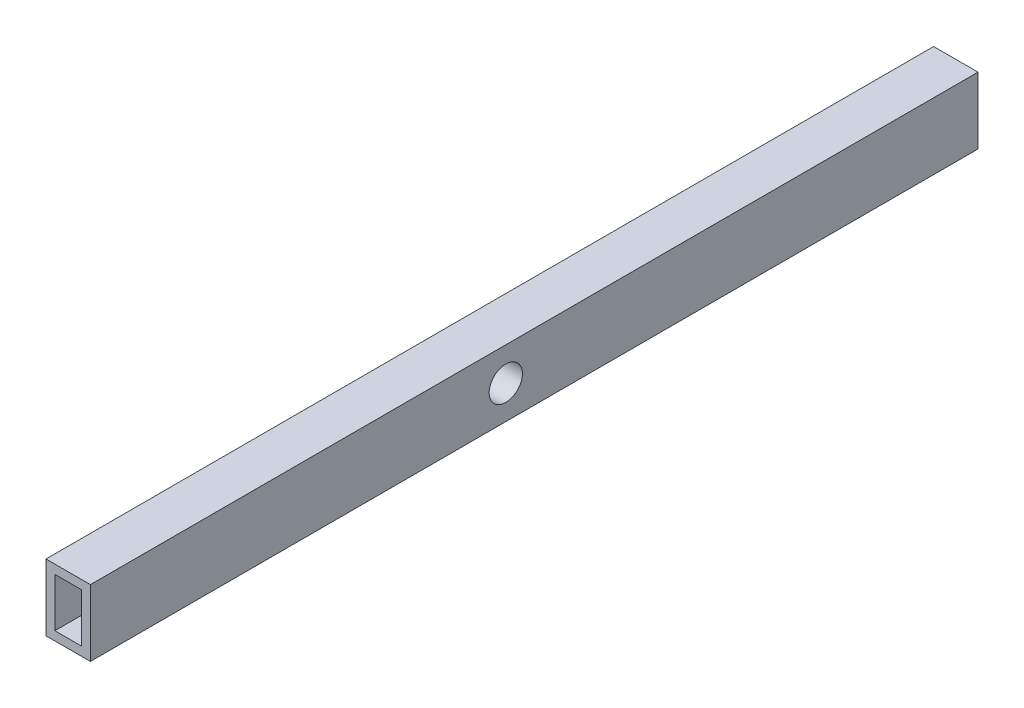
SolidWorks part; units mm, degrees
ref_plane "Front" through (0, 0, 0) normal (0, 0, 1) x (1, 0, 0)
ref_plane "Top" through (0, 0, 0) normal (0, 1, 0) x (1, 0, 0)
ref_plane "Right" through (0, 0, 0) normal (1, 0, 0) x (0, 0, -1)
sketch "Sketch1" plane through (0, 0, 0) normal (0, 0, 1) x (1, 0, 0)
  line L0 (0, 19.05) -> (0, 0)
  line L1 (0, 0) -> (12.7, 0)
  line L2 (0, 19.05) -> (12.7, 19.05)
  line L3 (12.7, 19.05) -> (12.7, 0)
  dimension "D1" = 12.7
  dimension "D2" = 19.05
extrude "Extrude-Thin1" add sketch "Sketch1" along normal blind 254 thin
hole_wizard "3/8 (0.375000) Diameter Hole1" positions "Sketch4" profile "Sketch3" hole size "3/8" standard "Ansi Inch"
sketch "Sketch4" plane through (12.7, 0, 0) normal (1, 0, 0) x (0, 0, -1)
  line L0 (-254, 0) -> (0, 0) construction
  point P0 (-135.1299, 9.525)
  dimension "D1" = 9.525
sketch "Sketch3" plane through (12.7, 9.525, 135.1299) normal (0, 1, 0) x (0, 0, -1)
  line L0 (0, 0) -> (0, 12.7)
  line L1 (0, 12.7) -> (4.7625, 12.7)
  line L2 (4.7625, 12.7) -> (4.7625, 0)
  line L5 (4.7625, 0) -> (0, 0)
  line L11 (0, -6.35) -> (0, 107.95) construction
  dimension "Thru Hole Dia." = 9.525
  dimension "Thru Hole Depth" = 12.7
sketch "Sketch5" plane through (12.7, 0, 0) normal (1, 0, 0) x (0, 0, -1)
  circle A0 centre (-135.1299, 9.525) radius 4.7625 construction
  circle A1 centre (-135.1299, 9.525) radius 4.7625
extrude "Extrude-Thin2" add sketch "Sketch5" against normal blind 12.7 thin
